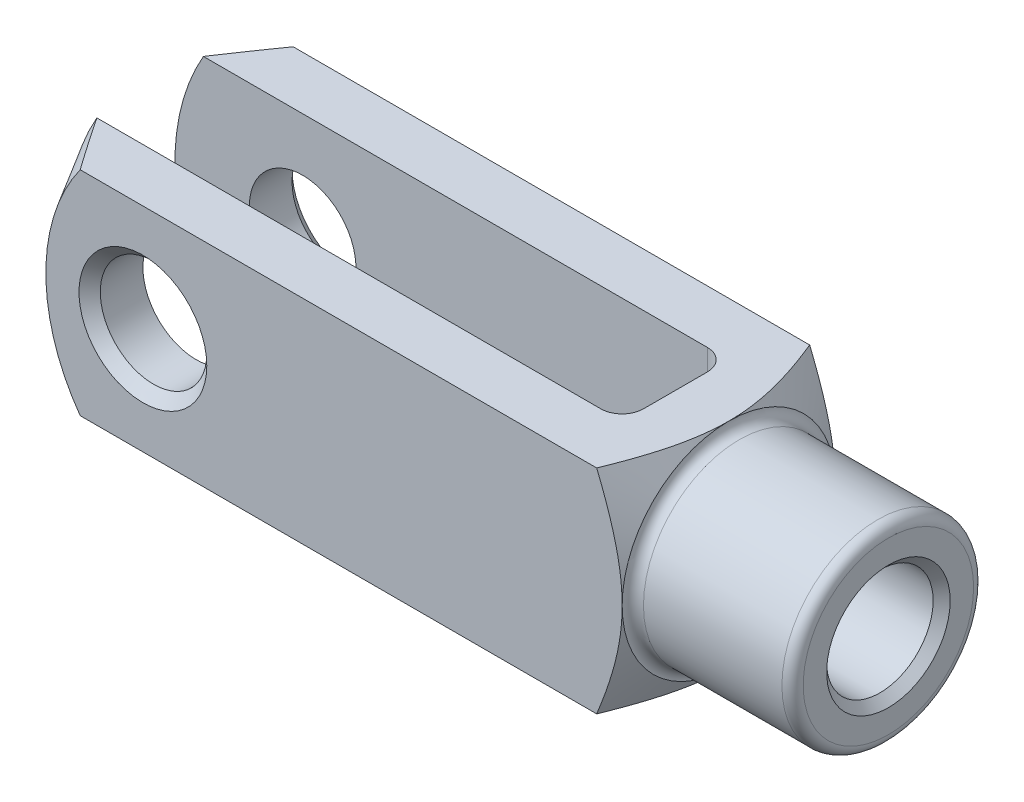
SolidWorks part; units mm, degrees
ref_plane "Front Plane" through (0, 0, 0) normal (0, 0, 1) x (1, 0, 0)
ref_plane "Top Plane" through (0, 0, 0) normal (0, 1, 0) x (1, 0, 0)
ref_plane "Right Plane" through (0, 0, 0) normal (1, 0, 0) x (0, 0, -1)
sketch "Sketch1" plane through (0, 0, 0) normal (1, 0, 0) x (0, 0, -1)
  line L0 (0, 0) -> (0, 50000) construction
  line L1 (0, 0) -> (50000, 0) construction
  line L2 (-5, -5) -> (-5, 5)
  line L3 (-5, 5) -> (5, 5)
  line L4 (5, -5) -> (5, 5)
  line L5 (-5, -5) -> (5, -5)
  point P9 (0, 5)
  point P11 (5, 0)
  point P12 (-5, 0)
  dimension "D1" = 10
  dimension "D2" = 10
extrude "Extrude1" add sketch "Sketch1" against normal blind 36
sketch "Sketch2" plane through (0, 0, 0) normal (1, 0, 0) x (0, 0, -1)
  circle A0 centre (0, 0) radius 4.5
  circle A1 centre (0, 0) radius 9
  dimension "D1" = 9
  dimension "D2" = 18
extrude "Extrude2" cut sketch "Sketch2" against normal blind 7.5
sketch "Sketch3" plane through (0, 0, 5) normal (0, 0, 1) x (1, 0, 0)
  circle A0 centre (-30, 0) radius 2.5
  dimension "D1" = 5
  dimension "D2" = 30
extrude "Extrude3" cut sketch "Sketch3" against normal through all
sketch "Sketch4" plane through (0, 5, 0) normal (0, 1, 0) x (1, 0, 0)
  line L0 (0, 0) -> (-50000, 0) construction
  line L1 (-36, -2.5) -> (-36, 2.5)
  line L2 (-36, 5) -> (-36, -5) construction
  line L3 (-36, 2.5) -> (-10, 2.5)
  line L4 (-10, 2.5) -> (-10, -2.5)
  line L5 (-30, 5) -> (-30, -5) construction
  line L6 (-36, -2.5) -> (-10, -2.5)
  point P7 (-30, 0)
  point P13 (-10, 0)
  point P14 (-36, 0)
  dimension "D1" = 20
  dimension "D2" = 5
extrude "Extrude4" cut sketch "Sketch4" against normal through all
fillet "Fillet1" radius 1 2 edges at (-10, 0, 2.5) (-10, 0, -2.5)
fillet "Fillet2" radius 0.5 2 edges at (0, 0, -4.5) (-7.5, 0, -4.5)
chamfer "Chamfer2" distance 0.5 angle 45 2 edges at (-27.5, 0, -5) (-27.5, 0, 5)
sketch "Sketch6" plane through (0, 0, 0) normal (0, 0, 1) x (1, 0, 0)
  line L0 (-7.5, -5) -> (-7.5, -10)
  line L1 (-7.5, -10) -> (-10.3868, -10)
  line L2 (-10.3868, -10) -> (-7.5, -5)
  dimension "D1" = 30
  dimension "D2" = 10
revolve "Cut-Revolve1" cut sketch "Sketch6" angle 360 about axis through (-7.5, 0, 0) along (1, 0, 0)
sketch "Sketch7" plane through (0, 0, 0) normal (0, 1, 0) x (1, 0, 0)
  line L0 (-34.5566, -5) -> (-36, -2.5)
  line L1 (-36, 2.5) -> (-34.5566, 5)
  line L2 (-34.5566, 5) -> (-46, 5)
  line L3 (-36, 2.5) -> (-36, -2.5)
  line L4 (-46, 5) -> (-46, -5)
  line L5 (-46, -5) -> (-34.5566, -5)
  line L6 (-36, 5) -> (-8.6957, 5) construction
  line L7 (-36, -5) -> (-8.6957, -5) construction
  line L8 (-26, 0.6162) -> (-26, 50000.6162) construction
  dimension "D1" = 120
  dimension "D2" = 10
  dimension "D3" = 10
revolve "Cut-Revolve2" cut sketch "Sketch7" angle 180 about L8
sketch "Sketch8" plane through (0, 0, 0) normal (1, 0, 0) x (0, 0, -1)
  circle A0 centre (0, 0) radius 2.5
  dimension "D1" = 5
extrude "Extrude5" cut sketch "Sketch8" against normal through all
chamfer "Chamfer3" distance 0.4 angle 45 1 edges at (0, 0, -2.5)
equation "\"D2@Sketch1\" = \"D1@Sketch1\""
equation "\"D2@Sketch2\" = \"D1@Sketch2\"*2"
equation "\"D2@Sketch6\" = \"D1@Sketch1\""
equation "\"D2@Sketch7\" = \"D1@Sketch1\""
equation "\"D3@Sketch7\" = \"D1@Sketch1\""
